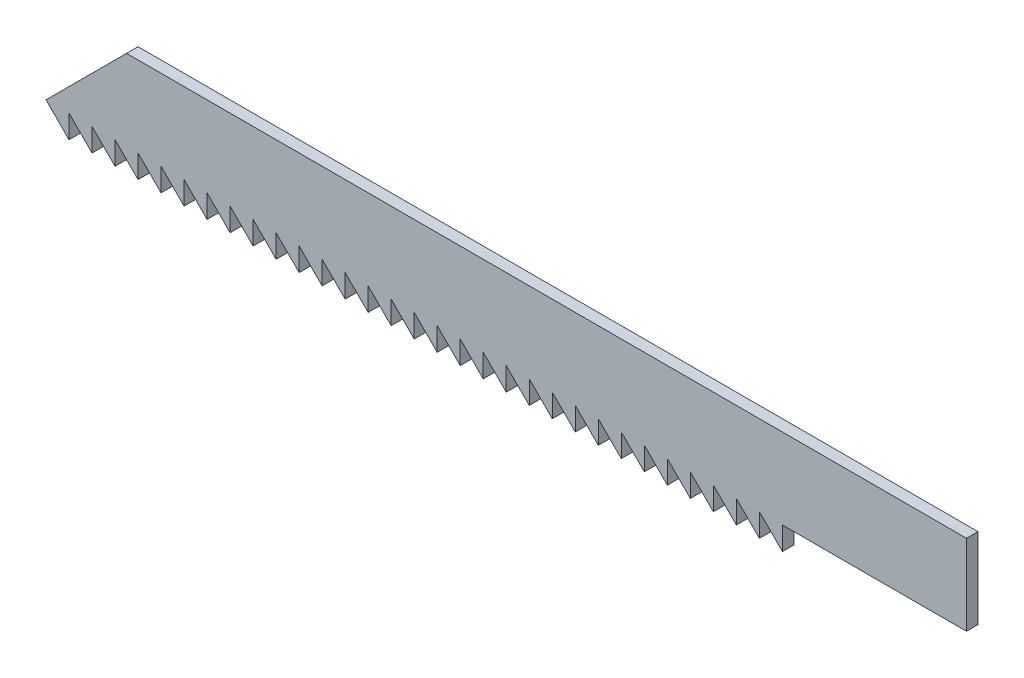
SolidWorks part; units mm, degrees
ref_plane "Plan1" through (0, 0, 0) normal (0, 0, 1) x (1, 0, 0)
ref_plane "Plan2" through (0, 0, 0) normal (0, 1, 0) x (1, 0, 0)
ref_plane "Plan3" through (0, 0, 0) normal (1, 0, 0) x (0, 0, -1)
sketch "Esquisse1" plane through (0, 0, 0) normal (0, 0, 1) x (1, 0, 0)
  line L0 (-40, 0) -> (-33, 7)
  line L1 (-40, 0) -> (40, 0)
  line L3 (-33, 7) -> (40, 7)
  line L4 (40, 0) -> (40, 7)
  dimension "D1" = 80
  dimension "D2" = 7
  dimension "D3" = 45
extrude "Base-Extrusion" add sketch "Esquisse1" along normal blind 1
sketch "Esquisse2" plane through (0, 0, 1) normal (0, 0, 1) x (1, 0, 0)
  line L0 (-40, 0) -> (40, 0) construction
  line L1 (-40, 0) -> (-38, 0)
  line L2 (-40, 0) -> (-38, -2)
  line L3 (-38, -2) -> (-38, 0)
  dimension "D1" = 2
  dimension "D2" = 2
extrude "Boss.-Extru.1" add sketch "Esquisse2" along normal up to surface (1 mm away)
pattern_linear "Répétition linéaire1" count 32 spacing 2
